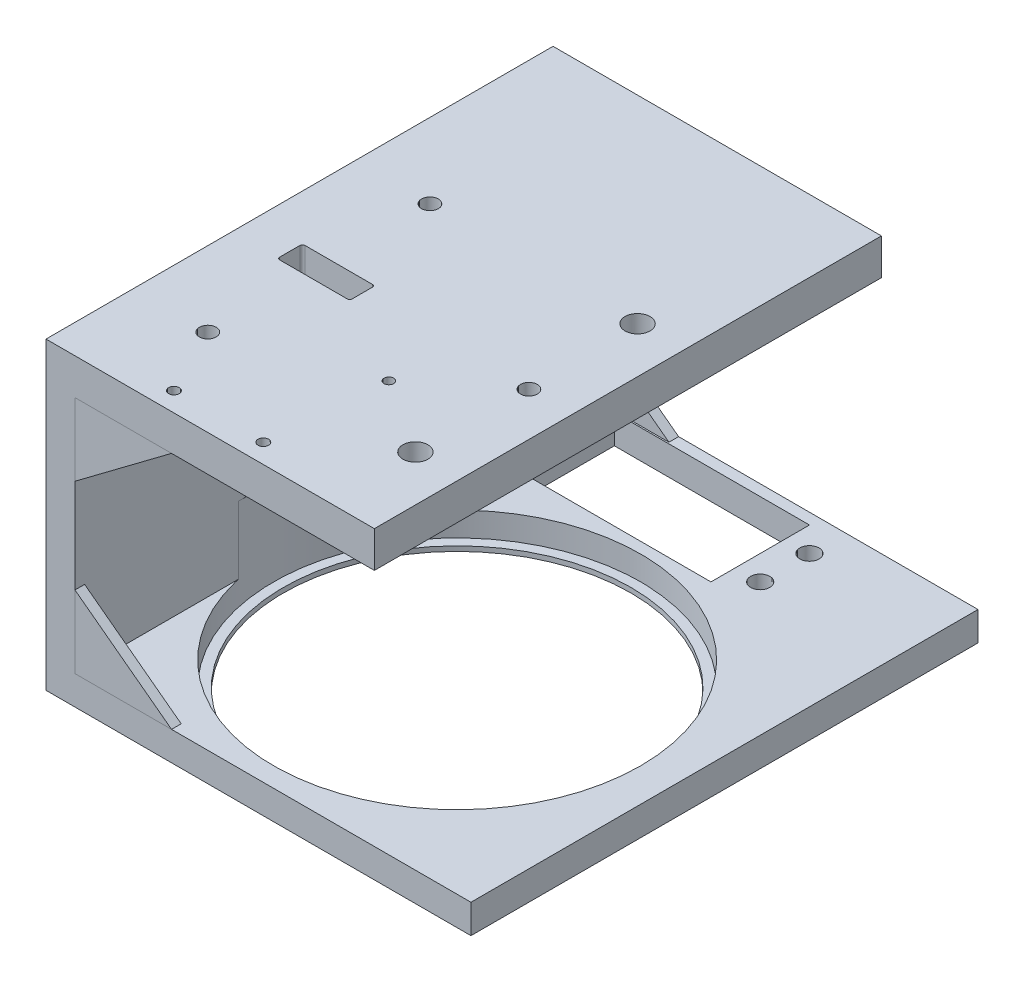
SolidWorks part; units mm, degrees
ref_plane "Alzado" through (0, 0, 0) normal (0, 0, 1) x (1, 0, 0)
ref_plane "Planta" through (0, 0, 0) normal (0, 1, 0) x (1, 0, 0)
ref_plane "Vista lateral" through (0, 0, 0) normal (1, 0, 0) x (0, 0, -1)
other "Graphic1"
other "Graphic (Closed) -1"
imported_body "Imported1"
other "Convert Mesh to Standard1"
sketch "Sketch2" plane through (0, 6, 0) normal (0, 1, 0) x (1, 0, 0)
  line L0 (-41.5, 18) -> (-41.5, -29.2171) construction
  line L5 (-20, -5) -> (-56.3474, -5) construction
  line L7 (-47.5, -2.3965) -> (-32.5, -2.3965)
  line L8 (-47.5, -2.3965) -> (-47.5, -7.6104)
  line L9 (-47.5, -7.6104) -> (-32.5, -7.6104)
  line L10 (-32.5, -2.3965) -> (-32.5, -7.6104)
  line L11 (-50, -29) -> (-50, 19) construction
  spline S0 degree 3 number of poles 76 (-38.9081, -3.4801) -> (-38.9081, -3.4801) construction
  point P2 (-41.5, -5)
  dimension "D1" = 15
  dimension "D2" = 2.5
extrude "Cut-Extrude1" cut sketch "Sketch2" against normal blind 26
sketch "Sketch3" plane through (0, 6, 0) normal (0, 1, 0) x (1, 0, 0)
  line L0 (10, 19) -> (10, -22.9528)
  line L1 (10, -22.9528) -> (36.8077, -22.9528)
  line L2 (36.8077, -22.9528) -> (36.8077, 19)
  line L3 (36.8077, 19) -> (10, 19)
extrude "Cut-Extrude2" cut sketch "Sketch3" against normal blind 10
sketch "Sketch5" plane through (0, 6, 0) normal (0, 1, 0) x (1, 0, 0)
  line L1 (-45.2909, -23.8529) -> (-37.7091, -23.8529)
  line L2 (-45.2909, -23.8529) -> (-45.2909, -32.1471)
  line L3 (-45.2909, -32.1471) -> (-37.7091, -32.1471)
  line L4 (-37.7091, -23.8529) -> (-37.7091, -32.1471)
  line L5 (-45.2909, -23.8529) -> (-37.7091, -32.1471) construction
  line L6 (-45.2909, -32.1471) -> (-37.7091, -23.8529) construction
  line L7 (-45.2909, 22.0648) -> (-37.7091, 22.0648)
  line L8 (-45.2909, 22.0648) -> (-45.2909, 13.9352)
  line L9 (-45.2909, 13.9352) -> (-37.7091, 13.9352)
  line L10 (-37.7091, 22.0648) -> (-37.7091, 13.9352)
  line L11 (-45.2909, 22.0648) -> (-37.7091, 13.9352) construction
  line L12 (-45.2909, 13.9352) -> (-37.7091, 22.0648) construction
  line L13 (-1.8471, -0.8312) -> (4.8471, -0.8312)
  line L14 (-1.8471, -0.8312) -> (-1.8471, -9.1688)
  line L15 (-1.8471, -9.1688) -> (4.8471, -9.1688)
  line L16 (4.8471, -0.8312) -> (4.8471, -9.1688)
  line L17 (-1.8471, -0.8312) -> (4.8471, -9.1688) construction
  line L18 (-1.8471, -9.1688) -> (4.8471, -0.8312) construction
  circle A0 centre (1.5, -5) radius 1.75
  circle A1 centre (-41.5, 18) radius 1.75
  circle A2 centre (-41.5, -28) radius 1.75
  dimension "D1" = 3.5
  dimension "D2" = 3.5
  dimension "D3" = 3.5
extrude "Boss-Extrude2" add sketch "Sketch5" against normal up to surface (6 mm away)
sketch "Sketch6" plane through (0, 6, 0) normal (0, 1, 0) x (1, 0, 0)
  line L1 (-28.8731, 10.1036) -> (-11.436, 10.1036)
  line L2 (-28.8731, 10.1036) -> (-28.8731, -20.0523)
  line L7 (-28.8731, -20.0523) -> (-11.436, -20.0523)
  line L8 (-11.436, 10.1036) -> (-11.436, -20.0523)
  line L9 (-28.8731, 10.1036) -> (-11.436, -20.0523) construction
  line L10 (-28.8731, -20.0523) -> (-11.436, 10.1036) construction
  point P0 (-20.1546, -4.9744)
extrude "Boss-Extrude4" add sketch "Sketch6" against normal up to surface (6 mm away)
sketch "Sketch8" plane through (0, 6, 0) normal (0, 1, 0) x (1, 0, 0)
  line L1 (-45.1307, 8.6164) -> (-38.1558, 8.6164)
  line L2 (-45.1307, 8.6164) -> (-45.1307, 2.5646)
  line L3 (-45.1307, 2.5646) -> (-38.1558, 2.5646)
  line L4 (-38.1558, 8.6164) -> (-38.1558, 2.5646)
  line L5 (-45.1307, 8.6164) -> (-38.1558, 2.5646) construction
  line L6 (-45.1307, 2.5646) -> (-38.1558, 8.6164) construction
  line L7 (-45.0794, -11.5902) -> (-37.4891, -11.5902)
  line L8 (-45.0794, -11.5902) -> (-45.0794, -20.9242)
  line L9 (-45.0794, -20.9242) -> (-37.4891, -20.9242)
  line L10 (-37.4891, -11.5902) -> (-37.4891, -20.9242)
  line L11 (-45.0794, -11.5902) -> (-37.4891, -20.9242) construction
  line L12 (-45.0794, -20.9242) -> (-37.4891, -11.5902) construction
  line L13 (-24.6164, -23.8988) -> (-14.4619, -23.8988)
  line L14 (-24.6164, -23.8988) -> (-24.6164, -32.6173)
  line L15 (-24.6164, -32.6173) -> (-14.4619, -32.6173)
  line L16 (-14.4619, -23.8988) -> (-14.4619, -32.6173)
  line L17 (-4.9227, -12.5646) -> (4.6164, -12.5646)
  line L18 (-4.9227, -12.5646) -> (-4.9227, -19.7959)
  line L19 (-4.9227, -19.7959) -> (4.6164, -19.7959)
  line L20 (4.6164, -12.5646) -> (4.6164, -19.7959)
  line L21 (-2.7174, 9.1292) -> (4.6164, 9.1292)
  line L22 (-2.7174, 9.1292) -> (-2.7174, 2.5646)
  line L23 (-2.7174, 2.5646) -> (4.6164, 2.5646)
  line L24 (4.6164, 9.1292) -> (4.6164, 2.5646)
  line L25 (-23.8984, 21.3352) -> (-15.3337, 21.3352)
  line L26 (-23.8984, 21.3352) -> (-23.8984, 13.9501)
  line L27 (-23.8984, 13.9501) -> (-15.3337, 13.9501)
  line L28 (-15.3337, 21.3352) -> (-15.3337, 13.9501)
  point P0 (-41.6433, 5.5905)
  point P5 (-41.2843, -16.2572)
extrude "Boss-Extrude5" add sketch "Sketch8" against normal up to surface (6 mm away)
sketch "Sketch9" plane through (0, 6, 0) normal (0, 1, 0) x (1, 0, 0)
  line L1 (-2.471, 0.3989) -> (5.6873, 0.3989)
  line L2 (-2.471, 0.3989) -> (-2.471, -11.8639)
  line L3 (-2.471, -11.8639) -> (5.6873, -11.8639)
  line L4 (5.6873, 0.3989) -> (5.6873, -11.8639)
extrude "Boss-Extrude6" add sketch "Sketch9" against normal up to surface (6 mm away)
sketch "Sketch10" plane through (0, 6, 0) normal (0, 1, 0) x (1, 0, 0)
  line L0 (-41.5, -5) -> (12.1351, -5) construction
  line L1 (10, 8) -> (10, -18) construction
  circle A0 centre (2, -5) radius 1.75
  dimension "D1" = 3.5
  dimension "D2" = 8
extrude "Cut-Extrude4" cut sketch "Sketch10" against normal blind 10
sketch "Sketch13" plane through (0, 6, 0) normal (0, 1, 0) x (1, 0, 0)
  line L0 (-50, 19) -> (-44, 25)
  line L1 (-44, 25) -> (4, 25)
  line L2 (4, 25) -> (10, 19)
  line L3 (10, 19) -> (10, -29)
  line L4 (10, -29) -> (4, -35)
  line L5 (4, -35) -> (-44, -35)
  line L6 (-44, -35) -> (-50, -29)
  line L7 (-50, -29) -> (-50, 19)
  line L9 (-51, -46) -> (11, -46)
  line L10 (-51, -46) -> (-51, 59)
  line L11 (-51, 59) -> (11, 59)
  line L12 (11, -46) -> (11, 59)
  line L13 (-51, -46) -> (11, 59) construction
  line L14 (-51, 59) -> (11, -46) construction
  point P16 (-20, 6.5)
  dimension "D1" = 34
  dimension "D2" = 1
  dimension "D3" = 1
  dimension "D4" = 11
extrude "Boss-Extrude7" add sketch "Sketch13" against normal blind 7.5
sketch "Sketch16" plane through (0, 0, 0) normal (0, -1, 0) x (-1, 0, 0)
  line L0 (-11, -46) -> (-11, 59) construction
  line L2 (51, -46) -> (-11, -46) construction
  circle A0 centre (14, -18) radius 1
  circle A1 centre (14, -3.8) radius 11.1
  dimension "D1" = 2
  dimension "D4" = 22.2
  dimension "D2" = 25
  dimension "D3" = 28
  dimension "D5" = 14.2
extrude "Cut-Extrude6" cut sketch "Sketch16" against normal blind 10
sketch "Sketch18" plane through (0, 0, 46) normal (0, 0, 1) x (1, 0, 0)
  line L1 (-57, 6) -> (-57, -57)
  line L2 (-57, -57) -> (31, -57)
  line L10 (-51, -51) -> (31, -51)
  line L11 (-51, -1.5) -> (11, -1.5) construction
  line L12 (-57, 6) -> (-51, 6)
  line L13 (-51, 6) -> (-51, -51)
  line L14 (31, -51) -> (31, -57)
  dimension "D1" = 6
  dimension "D2" = 88
  dimension "D3" = 6
  dimension "D4" = 49.5
extrude "Boss-Extrude9" add sketch "Sketch18" against normal up to surface (105 mm away)
sketch "Sketch19" plane through (0, -57, 0) normal (0, -1, 0) x (1, 0, 0)
  line L2 (-57, -59) -> (-57, 46) construction
  line L3 (-57, 46) -> (31, 46) construction
  circle A0 centre (-13.89, 3.97) radius 38
  dimension "D1" = 38
  dimension "D2" = 43.11
  dimension "D3" = 42.03
extrude "Cut-Extrude7" cut sketch "Sketch19" against normal blind 20
sketch "Sketch20" plane through (0, -57, 0) normal (0, -1, 0) x (1, 0, 0)
  circle A0 centre (-13.89, 3.97) radius 38
  circle A1 centre (-13.89, 3.97) radius 38 construction
  circle A2 centre (-13.89, 3.97) radius 36
  dimension "D1" = 2
extrude "Boss-Extrude10" add sketch "Sketch20" against normal blind 1
sketch "Sketch21" plane through (0, -57, 0) normal (0, -1, 0) x (1, 0, 0)
  line L0 (-57, -59) -> (31, -59) construction
  line L1 (-57, -59) -> (-57, 46) construction
  line L2 (-49, -42) -> (-49, -51) construction
  line L3 (-42, -36.3) -> (-1.6, -36.3)
  line L4 (-42, -36.3) -> (-42, -56.7)
  line L5 (-42, -56.7) -> (-1.6, -56.7)
  line L6 (-1.6, -36.3) -> (-1.6, -56.7)
  line L7 (-42, -36.3) -> (-1.6, -56.7) construction
  line L8 (-42, -56.7) -> (-1.6, -36.3) construction
  line L9 (-49, -46.5) -> (5.4, -46.5) construction
  line L10 (5.4, -44.0606) -> (5.4, -48.9394) construction
  point P17 (-21.8, -46.5)
  dimension "D2" = 15
  dimension "D5" = 9
  dimension "D7" = 8
  dimension "D8" = 8
  dimension "D9" = 20.4
  dimension "D10" = 40.4
extrude "Cut-Extrude8" cut sketch "Sketch21" against normal blind 9 contours L4 L3 L6 L5
sketch "Sketch22" plane through (0, -57, 0) normal (0, -1, 0) x (1, 0, 0)
  line L0 (-42, -46.5) -> (-1.6, -46.5) construction
  line L1 (-42, -36.3) -> (-42, -56.7) construction
  line L2 (-1.6, -36.3) -> (-1.6, -56.7) construction
  line L3 (-21.8, -46.5) -> (-21.8, -31.1312) construction
  circle A0 centre (-47.1, -41.4) radius 2
  circle A1 centre (-47.1, -51.6) radius 2
  circle A2 centre (3.5, -41.4) radius 2
  circle A3 centre (3.5, -51.6) radius 2
  dimension "D1" = 4
  dimension "D2" = 4
  dimension "D3" = 4
  dimension "D4" = 4
  dimension "D5" = 5.1
  dimension "D6" = 5.1
  dimension "D7" = 25.3
  dimension "D8" = 25.3
extrude "Cut-Extrude9" cut sketch "Sketch22" against normal blind 9
sketch "Sketch23" plane through (0, 0, 46) normal (0, 0, 1) x (1, 0, 0)
  line L0 (-51, -16.5) -> (-31, -1.5)
  line L1 (-51, -51) -> (-51, -1.5) construction
  line L3 (-31, -1.5) -> (-51, -1.5)
  line L4 (-51, -1.5) -> (-51, -16.5)
  line L5 (-51, -26.25) -> (31.5345, -26.25) construction
  line L6 (-31, -51) -> (-51, -51)
  line L7 (-51, -51) -> (-51, -36)
  line L8 (-51, -36) -> (-31, -51)
  dimension "D1" = 15
  dimension "D2" = 20
extrude "Boss-Extrude11" add sketch "Sketch23" against normal blind 2 separate body
sketch "Sketch24" plane through (0, 0, -59) normal (0, 0, -1) x (-1, 0, 0)
  line L0 (51, -1.5) -> (31, -1.5)
  line L1 (31, -1.5) -> (51, -16.5)
  line L2 (51, -16.5) -> (51, -1.5)
  line L3 (51, -26.25) -> (-35.3674, -26.25) construction
  line L4 (51, -51) -> (51, -1.5) construction
  line L5 (51, -51) -> (31, -51)
  line L6 (51, -36) -> (51, -51)
  line L7 (31, -51) -> (51, -36)
extrude "Boss-Extrude12" add sketch "Sketch24" against normal blind 2
sketch "Sketch25" plane through (0, 0, 0) normal (0, -1, 0) x (1, 0, 0)
  line L0 (4, 35) -> (10, 29)
  line L1 (10, 29) -> (10, -19)
  line L2 (10, -19) -> (4, -25)
  line L3 (4, -25) -> (-44, -25)
  line L4 (4, -25) -> (-44, -25) construction
  line L5 (4, 35) -> (-44, 35)
  line L6 (-44, 35) -> (-50, 29)
  line L7 (-50, 29) -> (-50, -19)
  line L8 (-50, -19) -> (-44, -25)
  line L10 (-47.5, 7.6104) -> (-32.5, 7.6104)
  line L11 (-47.5, 7.6104) -> (-47.5, 2.3965)
  line L12 (-47.5, 2.3965) -> (-32.5, 2.3965)
  line L13 (-32.5, 7.6104) -> (-32.5, 2.3965)
  circle A0 centre (1.5257, 27.9949) radius 2.6
  circle A1 centre (-41.5, 28) radius 1.75
  circle A2 centre (-41.5, 28) radius 1.75 construction
  circle A3 centre (-14, 3.8) radius 11.1
  circle A4 centre (-14, 18) radius 1
  circle A5 centre (2, 5) radius 1.75
  circle A7 centre (1.4717, -18.0515) radius 2.6
  circle A8 centre (-41.5, -18) radius 1.75
  circle A9 centre (-41.5, -18) radius 1.75 construction
  circle A10 centre (-14, 3.8) radius 11.1 construction
  circle A11 centre (-14, 18) radius 1 construction
  circle A12 centre (2, 5) radius 1.75 construction
  spline S2 degree 3 number of poles 72 (4.0848, 28) -> (4.0848, 28) construction
  spline S4 degree 3 number of poles 72 (4.0848, -18) -> (4.0848, -18) construction
  dimension "D1" = 5.2
  dimension "D2" = 5.2
extrude "Boss-Extrude13" add sketch "Sketch25" along normal blind 1.5
fillet "Fillet1" radius 0.5
sketch "Sketch26" plane through (0, 6, 0) normal (0, 1, 0) x (1, 0, 0)
  circle A0 centre (-14, -3.8) radius 11.1
extrude "Boss-Extrude14" add sketch "Sketch26" against normal blind 0.4
sketch "Sketch27" plane through (0, 6, 0) normal (0, 1, 0) x (1, 0, 0)
  line L0 (-57, -46) -> (11, -46) construction
  line L1 (-57, 59) -> (-57, -46) construction
  circle A0 centre (-34.5, -42) radius 1.1
  circle A1 centre (-16, -42) radius 1.1
  point P8 (0, 0)
  point P9 (0, 0)
  dimension "D1" = 2.2
  dimension "D3" = 2.2
  dimension "D2" = 4
  dimension "21" = 22.5
  dimension "D4" = 18.5
extrude "Cut-Extrude10" cut sketch "Sketch27" against normal blind 16
